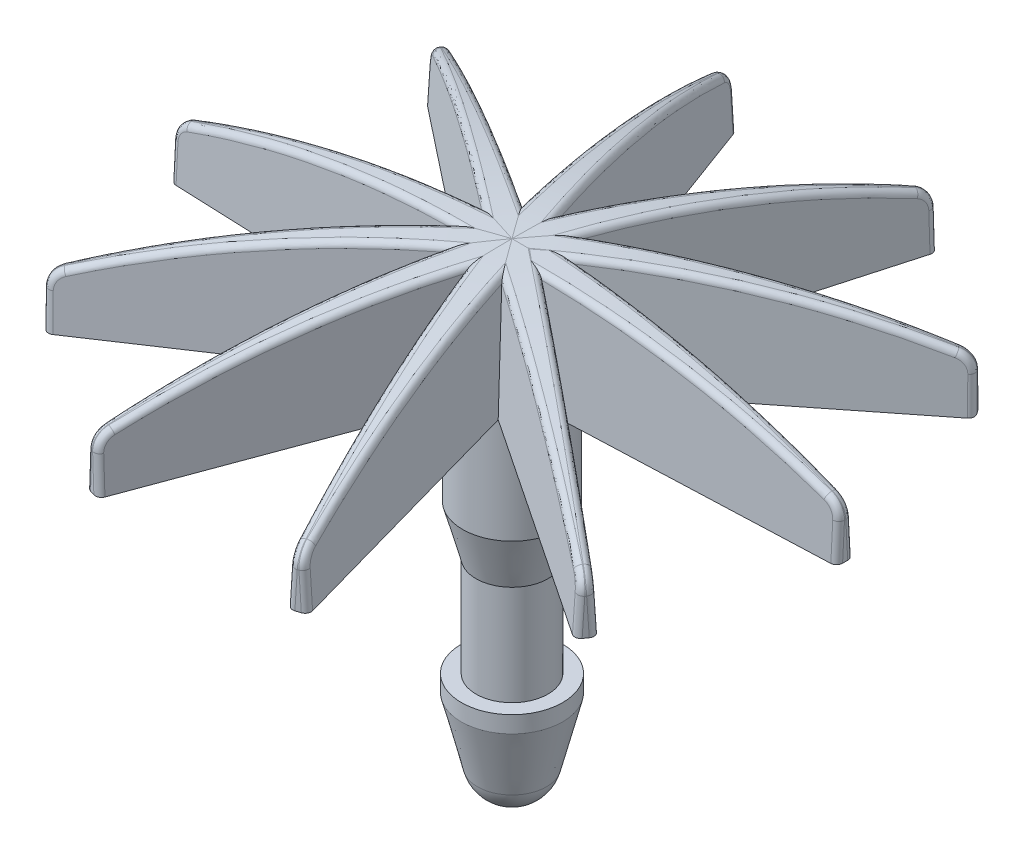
SolidWorks part; units mm, degrees
ref_plane "Front Plane" through (0, 0, 0) normal (0, 0, 1) x (1, 0, 0)
ref_plane "Top Plane" through (0, 0, 0) normal (0, 1, 0) x (1, 0, 0)
ref_plane "Right Plane" through (0, 0, 0) normal (1, 0, 0) x (0, 0, -1)
sketch "Sketch1" plane through (0, 0, 0) normal (1, 0, 0) x (0, 0, -1)
  line L0 (0, 0) -> (0, -74.1793) construction
sketch "Sketch2" plane through (0, 0, 0) normal (0, 1, 0) x (1, 0, 0)
  line L0 (0, -0.8255) -> (0, 0.8255)
  line L1 (0, 0.8255) -> (12.7, 0.3175)
  line L2 (12.7, 0.3175) -> (12.7, -0.3175)
  line L3 (0, 0) -> (4.3891, 0) construction
  line L4 (0, -0.8255) -> (12.7, -0.3175)
  line L5 (2.921, 0) -> (2.921, 0.7087) construction
  circle A0 centre (0, 0) radius 12.7 construction
  circle A1 centre (0, 0) radius 2.921 construction
  point P7 (12.7, 0)
  dimension "D1" = 25.4
  dimension "D3" = 5.842
  dimension "D2" = 0.635
  dimension "D4" = 1.651
  dimension "D5" = 0.7087
extrude "Boss-Extrude1" add sketch "Sketch2" along normal blind 4.318
sketch "Sketch4" plane through (0, 0, 0) normal (0, 0, 1) x (1, 0, 0)
  line L0 (0, 4.318) -> (-4.7954, 4.318) construction
  line L1 (12.7, 4.318) -> (12.7, 0) construction
  line L2 (12.7, 1.905) -> (12.7, 0) construction
  line L3 (0, 4.318) -> (0, 8.1714)
  line L4 (0, 8.1714) -> (17.1642, 8.1714)
  line L5 (12.7, 1.905) -> (17.1642, 1.905)
  line L6 (17.1642, 1.905) -> (17.1642, 8.1714)
  arc A0 (0, 4.318) -> (12.7, 1.905) centre (0, -30.3096) cw
  dimension "D1" = 1.905
extrude "Cut-Extrude1" cut sketch "Sketch4" along normal through all and the other way through all
draft "Draft1" type of draft neutral plane draft angle 3 faces to draft 2 parameters "D1"=3
fillet "Fillet1" radius 0.762 1 edges at (12.7, 1.905, 0)
fillet "Fillet2" radius 0.2286 6 edges at (12.7, 0.691, -0.2813) (12.5646, 1.8157, -0.2277) (12.7, 0.691, 0.2813) (12.5646, 1.8157, 0.2277) (6.2037, 3.7578, -0.3803) (6.2037, 3.7578, 0.3803)
sketch "Sketch5" plane through (0, 0, 0) normal (-1, 0, 0) x (0, 0, 1)
  line L0 (0, 0) -> (0, 7.1114)
pattern_circular "CirPattern3" count 10 over 360 about axis through (0, 0, 0) along (0, 1, 0) of "Boss-Extrude1", "Cut-Extrude1", "Fillet1", "Draft1", "Fillet2"
sketch "Sketch6" plane through (0, 0, 0) normal (0, -1, 0) x (1, 0, 0)
  circle A0 centre (0, 0) radius 1.8796
  dimension "D1" = 3.7592
extrude "Boss-Extrude2" add sketch "Sketch6" along normal blind 4.3434
sketch "Sketch7" plane through (0, -4.3434, 0) normal (0, -1, 0) x (1, 0, 0)
  circle A0 centre (0, 0) radius 1.3716
  dimension "D1" = 2.7432
extrude "Boss-Extrude5" add sketch "Sketch7" along normal offset from surface (5.6896 mm away) 10.033
sketch "Sketch8" plane through (0, 0, 0) normal (1, 0, 0) x (0, 0, -1)
  line L0 (1.3716, -10.033) -> (1.3716, -4.3434) construction
  line L1 (-1.8796, -4.3434) -> (1.8796, -4.3434) construction
  line L2 (1.3716, -6.223) -> (1.3716, -4.3434)
  line L3 (1.3716, -4.3434) -> (1.8796, -4.3434)
  line L4 (1.8796, -4.3434) -> (1.3716, -6.223)
  line L5 (0.735, 0) -> (7.0719, 0) construction
  dimension "D1" = 6.223
revolve "Revolve1" add sketch "Sketch8" angle 360 about L0
sketch "Sketch9" plane through (0, -10.033, 0) normal (0, -1, 0) x (1, 0, 0)
  circle A0 centre (0, 0) radius 1.9304
  dimension "D1" = 3.8608
extrude "Boss-Extrude6" add sketch "Sketch9" along normal blind 0.635
sketch "Sketch10" plane through (0, 0, 0) normal (1, 0, 0) x (0, 0, -1)
  line L0 (0, -10.668) -> (0, -14.7945) construction
  line L1 (-1.9304, -10.668) -> (1.9304, -10.668) construction
  line L2 (0, -10.668) -> (1.9304, -10.668)
  line L3 (1.9304, -10.033) -> (-1.9304, -10.033) construction
  line L4 (1.9304, -10.668) -> (1.3184, -13.1182)
  line L5 (0, -10.668) -> (0, -14.1478)
  arc A0 (0, -14.1478) -> (1.3184, -13.1182) centre (0, -12.7889) ccw
  dimension "D1" = 4.1148
  dimension "D2" = 2.7178
revolve "Revolve2" add sketch "Sketch10" angle 360 about L0
